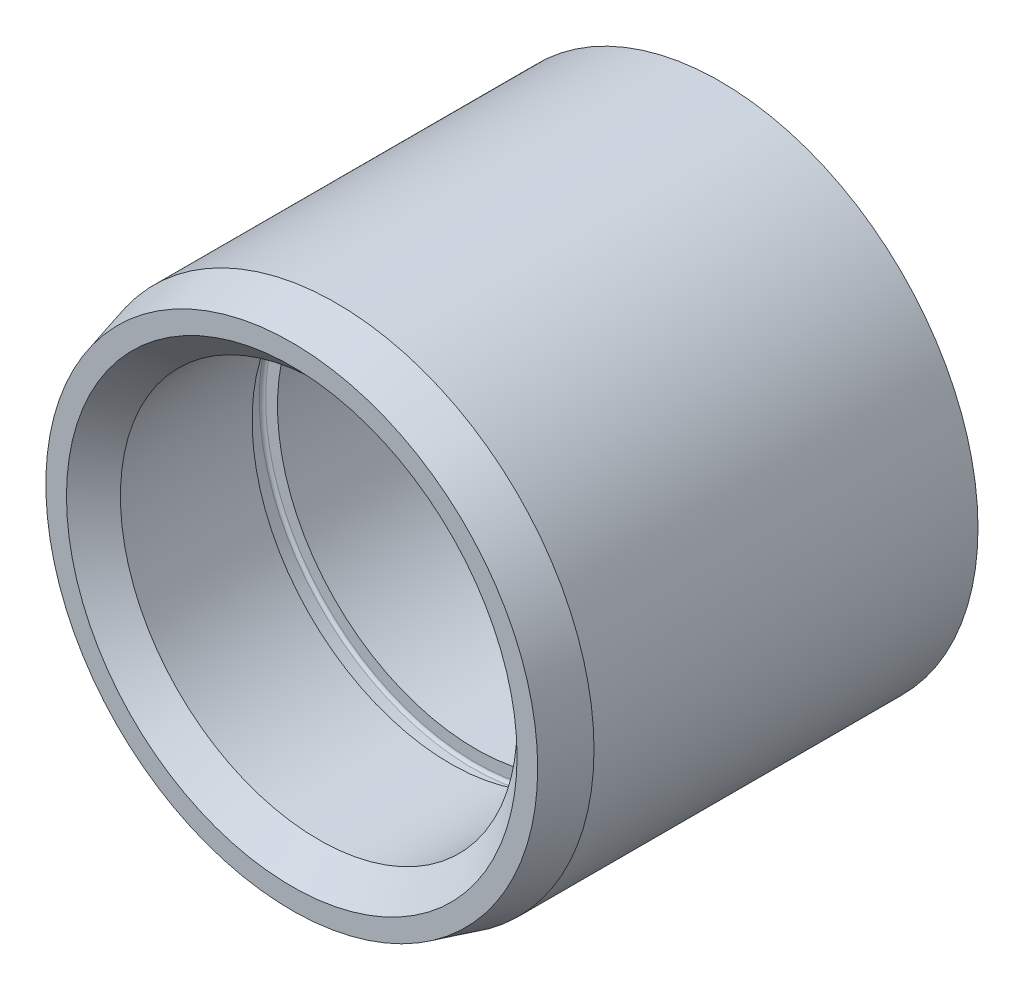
SolidWorks part; units mm, degrees
ref_plane "Plan de face" through (0, 0, 0) normal (0, 0, 1) x (1, 0, 0)
ref_plane "Plan de dessus" through (0, 0, 0) normal (0, 1, 0) x (1, 0, 0)
ref_plane "Plan de droite" through (0, 0, 0) normal (1, 0, 0) x (0, 0, -1)
sketch "Esquisse2" plane through (0, 0, 0) normal (1, 0, 0) x (0, 0, -1)
  line L0 (0, 0) -> (70.2273, 0) construction
  line L1 (8.8909, 32.5) -> (57.2928, 32.5)
  line L2 (57.2928, 32.5) -> (57.2928, 25)
  line L3 (57.2928, 25) -> (26.4928, 25)
  line L4 (3.2928, 28.4) -> (3.2928, 31)
  line L5 (6.6928, 25) -> (3.2928, 28.4)
  line L6 (8.8909, 32.5) -> (3.2928, 31)
  line L7 (26.4928, 25) -> (26.4928, 26.5)
  line L8 (26.0928, 26.9) -> (23.6928, 26.9)
  line L9 (23.2928, 26.5) -> (23.2928, 25)
  line L10 (23.2928, 25) -> (6.6928, 25)
  arc A0 (23.6928, 26.9) -> (23.2928, 26.5) centre (23.6928, 26.5) ccw
  arc A1 (26.4928, 26.5) -> (26.0928, 26.9) centre (26.0928, 26.5) ccw
  point P7 (3.2928, 25)
  dimension "D11" = 0.4
  dimension "D1" = 65
  dimension "D2" = 50
  dimension "D3" = 54
  dimension "D4" = 3.4
  dimension "D5" = 45
  dimension "D6" = 15
  dimension "D7" = 62
  dimension "D8" = 30.8
  dimension "D9" = 3.2
  dimension "D10" = 1.9
revolve "Révolution1" add sketch "Esquisse2" angle 360 about L0
sketch "Esquisse3" plane through (0, 0, -57.2928) normal (0, 0, -1) x (-1, 0, 0)
  line L0 (0, -36.8186) -> (0, 35.7303) construction
  circle A0 centre (0, 0) radius 28.75 construction
  point P5 (0, -28.75)
  point P6 (0, 28.75)
  dimension "D1" = 57.5
hole_wizard "Trou taraudé M41" positions "Esquisse3D1" profile "Esquisse4" tap size "M4" standard "ISO"
sketch3d "Esquisse3D1"
  point P0 (0, 28.75, -57.2928)
  point P3 (0, -28.75, -57.2928)
sketch "Esquisse4" plane through (0, 28.75, -57.2928) normal (1, 0, 0) x (0, 1, 0)
  line L0 (0, 0) -> (0, 10.9914)
  line L1 (0, 10.9914) -> (1.65, 10)
  line L2 (1.65, 10) -> (1.65, 0)
  line L5 (1.65, 0) -> (0, 0)
  line L10 (0, 10.9914) -> (-1.65, 10) construction
  line L11 (0, -6.35) -> (0, 107.95) construction
  dimension "Diamètre du trou pour taraudage" = 3.3
  dimension "Profondeur du trou pour taraudage" = 10
  dimension "Angle de pointe" = 118
